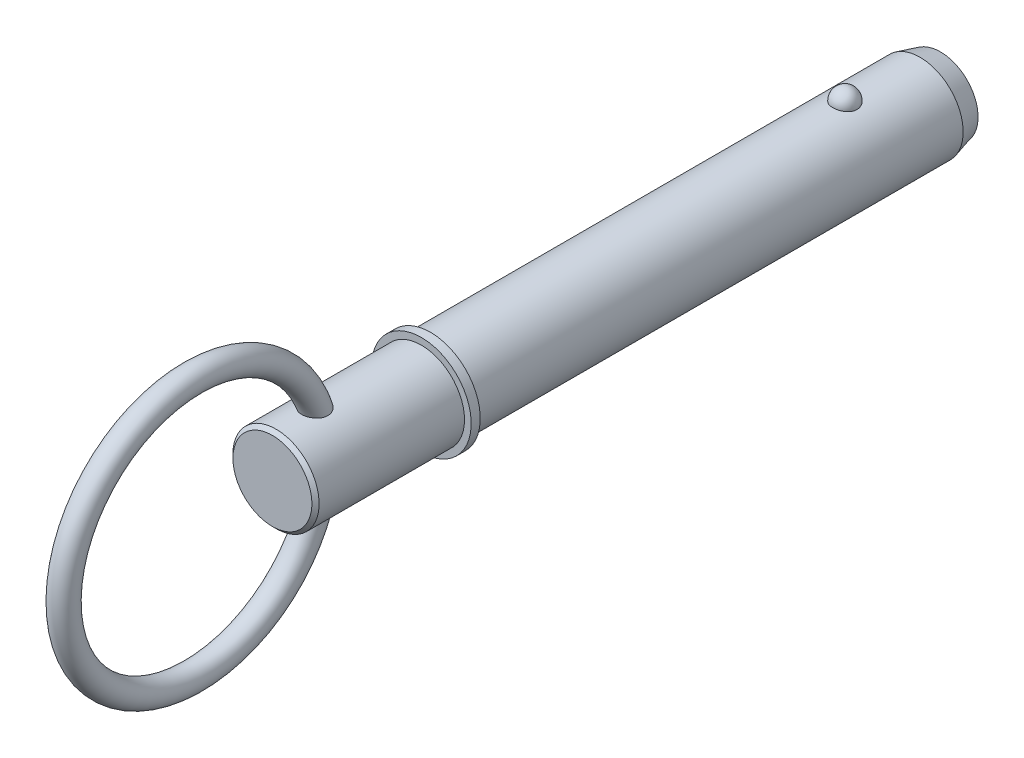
SolidWorks part; units mm, degrees
ref_plane "Front Plane" through (0, 0, 0) normal (0, 0, 1) x (1, 0, 0)
ref_plane "Top Plane" through (0, 0, 0) normal (0, 1, 0) x (1, 0, 0)
ref_plane "Right Plane" through (0, 0, 0) normal (1, 0, 0) x (0, 0, -1)
sketch "Sketch2" plane through (0, 0, 0) normal (0, 0, 1) x (1, 0, 0)
  circle A0 centre (0, 0) radius 9.525
  point P3 (0, 9.525)
  dimension "D1" = 19.05
extrude "Boss-Extrude1" add sketch "Sketch2" along normal blind 88.9
sketch "Sketch3" plane through (0, 0, 0) normal (0, 0, -1) x (-1, 0, 0)
  circle A0 centre (0, 0) radius 9.525
  dimension "D1" = 19.05
extrude "Boss-Extrude2" add sketch "Sketch3" along normal blind 23.8
chamfer "Chamfer1" distance 4.5 angle 15 1 edges at (-9.525, 0, -23.8)
sketch "Sketch18" plane through (0, 0, 0) normal (1, 0, 0) x (0, 0, -1)
  line L0 (19.3, 9.525) -> (-88.9, 9.525) construction
  line L1 (2.69, 12.215) -> (2.69, 6.835)
  line L2 (-88.9, -9.525) -> (19.3, -9.525) construction
  arc A0 (2.69, 12.215) -> (2.69, 6.835) centre (2.69, 9.525) ccw
  point P4 (0, 9.525)
  dimension "D1" = 21.74
revolve "Revolve1" add sketch "Sketch18" angle 360 about L1
sketch "Sketch19" plane through (0, 0, 0) normal (1, 0, 0) x (0, 0, -1)
  line L0 (-33.7288, 0) -> (-46.4542, 0) construction
sketch "Sketch20" plane through (0, 0, 0) normal (1, 0, 0) x (0, 0, -1)
  line L0 (-88.9, 0) -> (-88.9, 11)
  line L1 (-88.9, 9.525) -> (-88.9, -9.525) construction
  line L2 (-88.9, 11) -> (-90.9, 11)
  line L3 (-90.9, 11) -> (-90.9, 0)
  line L4 (-33.7288, 0) -> (-46.4542, 0) construction
  line L5 (-90.9, 0) -> (-88.9, 0)
  dimension "D1" = 11
  dimension "D2" = 2
revolve "Revolve2" add sketch "Sketch20" angle 360 about L0
sketch "Sketch21" plane through (0, 0, 88.9) normal (0, 0, -1) x (-1, 0, 0)
  circle A0 centre (0, 0) radius 9.525
  dimension "D1" = 19.05
extrude "Boss-Extrude3" add sketch "Sketch21" against normal blind 34.93
chamfer "Chamfer2" distance 0.8 angle 45 1 edges at (-9.525, 0, 123.83)
sketch "Sketch23" plane through (0, 0, 0) normal (1, 0, 0) x (0, 0, -1)
  line L0 (-123.83, 8.725) -> (-123.83, -8.725) construction
  circle A0 centre (-141.405, 0) radius 28.575
  point P2 (-112.83, 0)
  dimension "D1" = 57.15
  dimension "D2" = 11
sketch "Sketch24" plane through (0, 0, 0) normal (0, 1, 0) x (1, 0, 0)
  circle A0 centre (0, -112.83) radius 2.75
  dimension "D1" = 5.5
sweep "Sweep1" add profiles "Sketch24" path "Sketch23"
